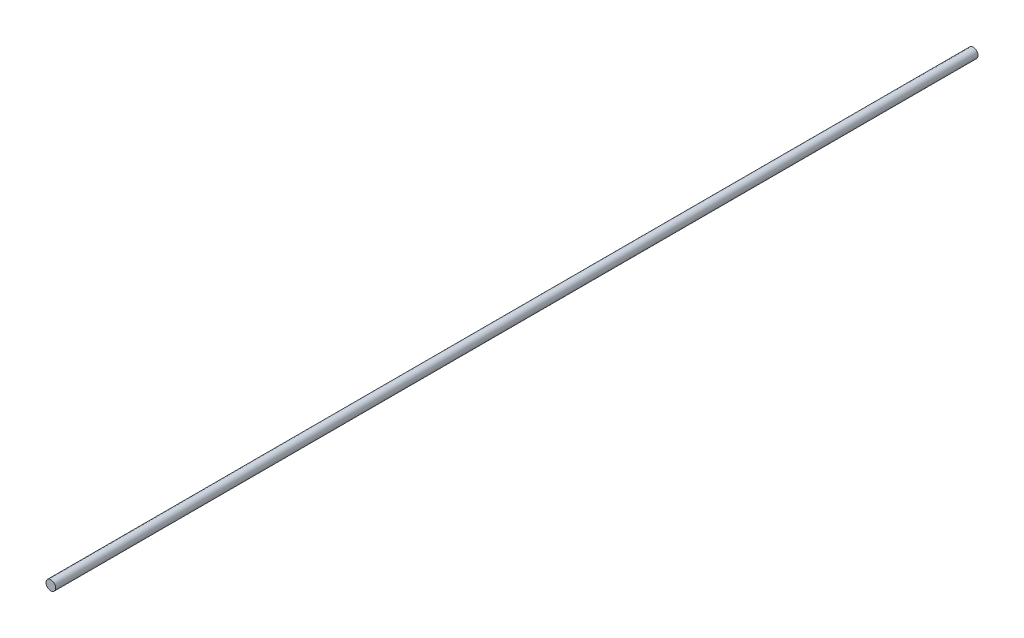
SolidWorks part; units mm, degrees
ref_plane "Front Plane" through (0, 0, 0) normal (0, 0, 1) x (1, 0, 0)
ref_plane "Top Plane" through (0, 0, 0) normal (0, 1, 0) x (1, 0, 0)
ref_plane "Right Plane" through (0, 0, 0) normal (1, 0, 0) x (0, 0, -1)
sketch "Sketch1" plane through (0, 0, 0) normal (0, 0, 1) x (1, 0, 0)
  circle A0 centre (0, 0) radius 30
  dimension "D1" = 60
extrude "Boss-Extrude1" add sketch "Sketch1" against normal blind 5750
